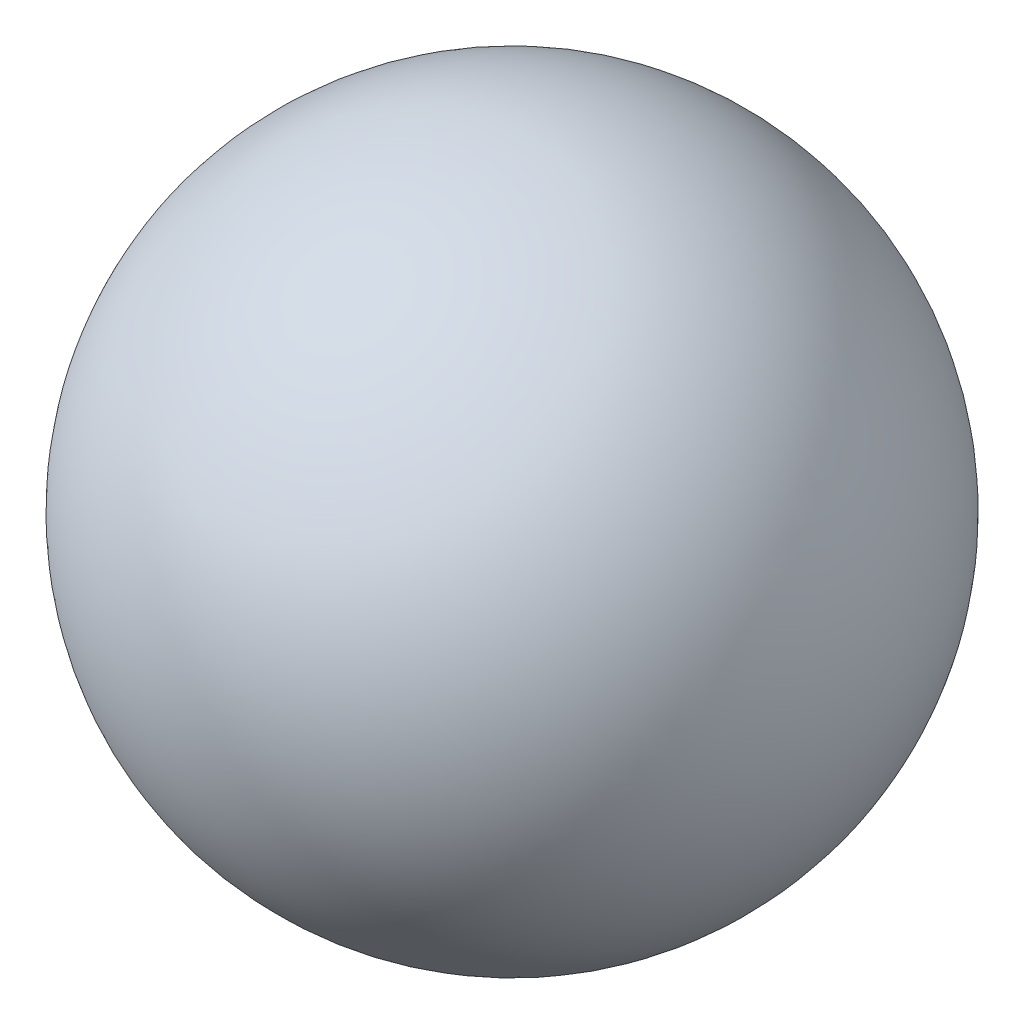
SolidWorks part; units mm, degrees
ref_plane "Alzado" through (0, 0, 0) normal (0, 0, 1) x (1, 0, 0)
ref_plane "Planta" through (0, 0, 0) normal (0, 1, 0) x (1, 0, 0)
ref_plane "Vista lateral" through (0, 0, 0) normal (1, 0, 0) x (0, 0, -1)
ref_plane "Plano1" through (0, 0, 0) normal (0, 0, 1) x (1, 0, 0)
sketch "Croquis1" plane through (0, 0, 0) normal (0, 0, 1) x (1, 0, 0)
  line L0 (16.247, 25.5) -> (2.753, 25.5)
  line L1 (16.247, 25.5) -> (2.753, 25.5) construction
  arc A0 (2.753, 25.5) -> (16.247, 25.5) centre (9.5, 25.5) cw
revolve "Revolución1" add sketch "Croquis1" angle 360 about L1
